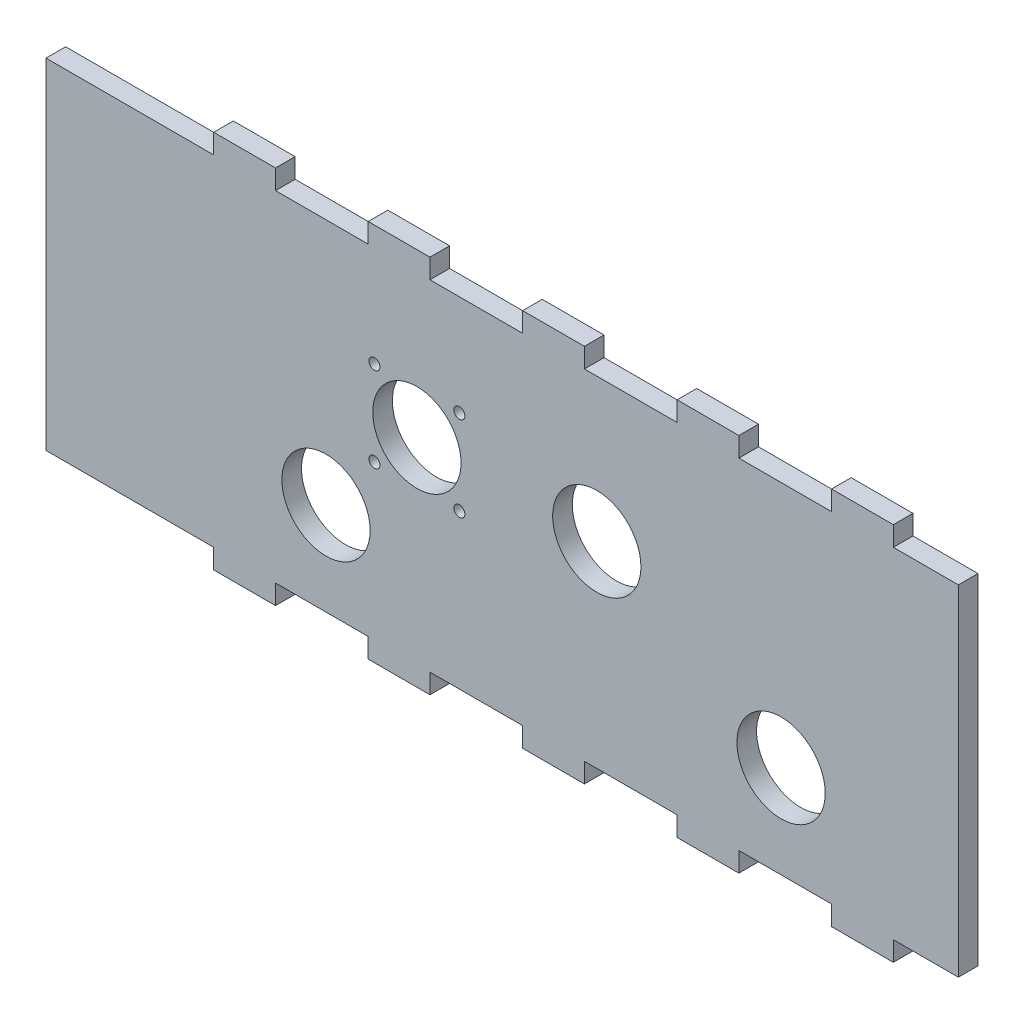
SolidWorks part; units mm, degrees
ref_plane "Front Plane" through (0, 0, 0) normal (0, 0, 1) x (1, 0, 0)
ref_plane "Top Plane" through (0, 0, 0) normal (0, 1, 0) x (1, 0, 0)
ref_plane "Right Plane" through (0, 0, 0) normal (1, 0, 0) x (0, 0, -1)
sketch "Sketch1" plane through (0, 0, 0) normal (0, 0, 1) x (1, 0, 0)
  line L0 (178.3064, 63.6704) -> (178.3064, 26.3194) construction
  line L1 (0, 0) -> (295.36, 0) construction
  line L5 (90.64, 30) -> (237.96, 30) construction
  line L6 (178.3064, 63.6704) -> (178.3064, 26.3194) construction
  line L7 (164.3, 30) -> (164.3, 0) construction
  line L8 (154.3, 0) -> (154.3, -6.35)
  line L9 (154.3, -6.35) -> (174.3, -6.35)
  line L10 (106.3176, 77.4192) -> (133.8151, 49.9216) construction
  line L11 (106.3176, 49.9216) -> (133.8151, 77.4192) construction
  line L12 (174.3, -6.35) -> (174.3, 0)
  line L13 (174.3, 0) -> (204.3, 0)
  line L16 (295.36, 110) -> (0, 110) construction
  line L17 (0, 110) -> (0, 0)
  line L18 (295.36, 110) -> (295.36, 0)
  line L19 (204.3, 0) -> (204.3, -6.35)
  line L20 (204.3, -6.35) -> (224.3, -6.35)
  line L21 (224.3, -6.35) -> (224.3, 0)
  line L22 (224.3, 0) -> (254.3, 0)
  line L23 (254.3, 0) -> (254.3, -6.35)
  line L24 (254.3, -6.35) -> (274.3, -6.35)
  line L25 (274.3, -6.35) -> (274.3, 0)
  line L26 (274.3, 0) -> (295.36, 0)
  line L27 (154.3, 0) -> (124.3, 0)
  line L28 (124.3, 0) -> (124.3, -6.35)
  line L29 (124.3, -6.35) -> (104.3, -6.35)
  line L30 (104.3, -6.35) -> (104.3, 0)
  line L31 (104.3, 0) -> (74.3, 0)
  line L32 (74.3, 0) -> (74.3, -6.35)
  line L33 (74.3, -6.35) -> (54.3, -6.35)
  line L34 (54.3, -6.35) -> (54.3, 0)
  line L35 (54.3, 0) -> (0, 0)
  line L36 (0, 55) -> (295.36, 55) construction
  line L37 (274.3, 110) -> (295.36, 110)
  line L38 (274.3, 116.35) -> (274.3, 110)
  line L39 (254.3, 116.35) -> (274.3, 116.35)
  line L40 (254.3, 110) -> (254.3, 116.35)
  line L41 (224.3, 110) -> (254.3, 110)
  line L42 (224.3, 116.35) -> (224.3, 110)
  line L43 (204.3, 116.35) -> (224.3, 116.35)
  line L44 (204.3, 110) -> (204.3, 116.35)
  line L45 (174.3, 110) -> (204.3, 110)
  line L46 (174.3, 116.35) -> (174.3, 110)
  line L47 (154.3, 116.35) -> (174.3, 116.35)
  line L48 (154.3, 110) -> (154.3, 116.35)
  line L49 (154.3, 110) -> (124.3, 110)
  line L50 (124.3, 110) -> (124.3, 116.35)
  line L51 (124.3, 116.35) -> (104.3, 116.35)
  line L52 (104.3, 116.35) -> (104.3, 110)
  line L53 (104.3, 110) -> (74.3, 110)
  line L54 (74.3, 110) -> (74.3, 116.35)
  line L55 (74.3, 116.35) -> (54.3, 116.35)
  line L56 (54.3, 116.35) -> (54.3, 110)
  line L57 (54.3, 110) -> (0, 110)
  circle A0 centre (90.64, 30) radius 14.2875
  circle A1 centre (237.96, 30) radius 14.2875
  circle A2 centre (178.3064, 63.6704) radius 14.2875
  circle A3 centre (120.0664, 63.6704) radius 14.2875
  circle A4 centre (120.0664, 63.6704) radius 19.4437 construction
  circle A5 centre (106.3176, 77.4192) radius 1.778
  circle A6 centre (106.3176, 49.9216) radius 1.778
  circle A7 centre (133.8151, 77.4192) radius 1.778
  circle A8 centre (133.8151, 49.9216) radius 1.778
  point P43 (164.3, -6.35)
  point P69 (90.64, 33.6806)
  dimension "D2" = 28.575
  dimension "D3" = 58.24
  dimension "D4" = 54.3
  dimension "D9" = 38.8874
  dimension "D10" = 3.556
  dimension "D5" = 147.32
  dimension "D6" = 68.5
  dimension "D7" = 93.91
  dimension "D8" = 110
  dimension "D11" = 20
  dimension "D12" = 30
  dimension "D13" = 6.35
  dimension "D14" = 21.06
  dimension "D15" = 30
extrude "Boss-Extrude1" add sketch "Sketch1" along normal blind 6.35
